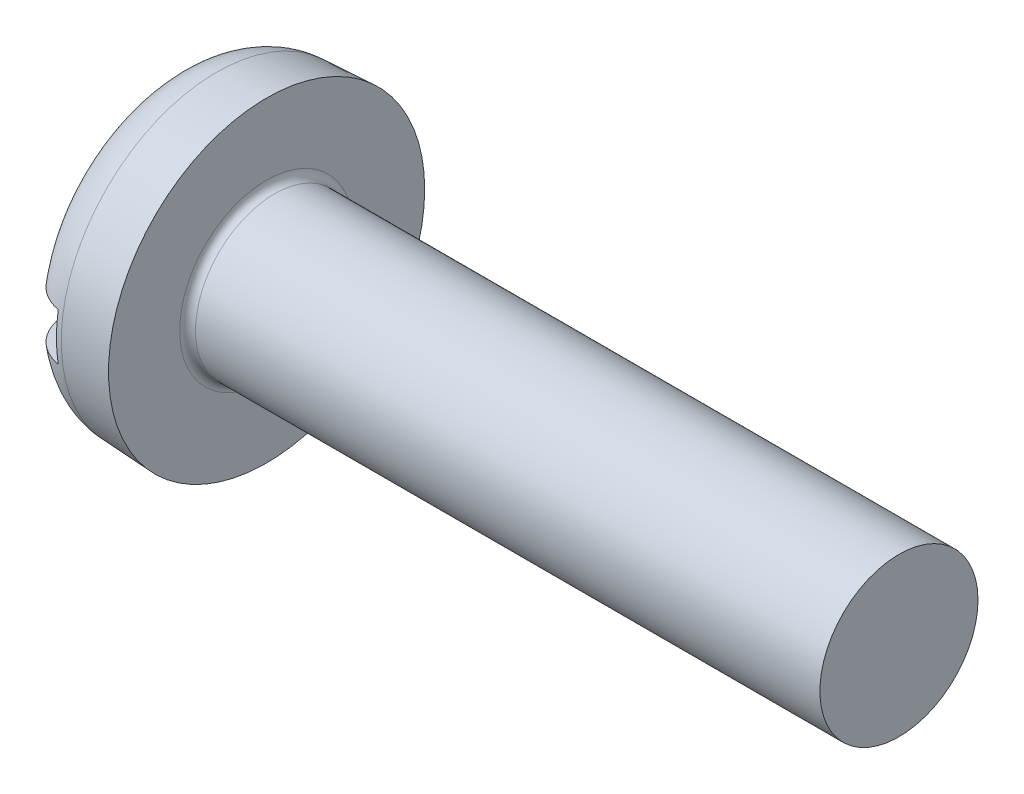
SolidWorks part; units mm, degrees
ref_plane "Front" through (0, 0, 0) normal (0, 0, 1) x (1, 0, 0)
ref_plane "Top" through (0, 0, 0) normal (0, 1, 0) x (1, 0, 0)
ref_plane "Right" through (0, 0, 0) normal (1, 0, 0) x (0, 0, -1)
other "Configuration Table"
ref_plane "Plane1" through (2.4, 0, 0) normal (1, 0, 0) x (0, 0, -1)
sketch "Sketch1" plane through (2.4, 0, 0) normal (1, 0, 0) x (0, 0, -1)
  circle A0 centre (0, 0) radius 4
  dimension "dk" = 8
extrude "BaseHead" add sketch "Sketch1" against normal blind 2.4 draft 3
sketch "Sketch2" plane through (2.4, 0, 0) normal (1, 0, 0) x (0, 0, -1)
  line L0 (0, 0) -> (1.4, 0) construction
  circle A0 centre (0, 0) radius 2
extrude "BaseBody" add sketch "Sketch2" along normal blind 16
fillet "HeadFillet2" radius 1.2 1 edges at (0, 0, -3.8742)
sketch "Sketch3" plane through (1.05, -1.05, 0) normal (0, 0, 1) x (0, -1, 0)
  line L1 (-1.65, -0.05) -> (-0.45, -0.05)
  line L2 (-1.65, -0.05) -> (-1.65, -1.05)
  line L3 (-1.65, -1.05) -> (-0.45, -1.05)
  line L4 (-0.45, -0.05) -> (-0.45, -1.05)
  line L5 (-3.7855, -1.05) -> (1.6855, -1.05) construction
extrude "Notch" cut sketch "Sketch3" against normal through all and the other way through all
fillet "HeadFillet1" radius 0.2 1 edges at (2.4, 0, -2)
sketch "Sketch4" plane through (0, 0, 0) normal (0, 0, 1) x (1, 0, 0)
  line L0 (-19.6, 6.621) -> (-19.6, 2)
  line L1 (2.4, 6.621) -> (-19.6, 6.621)
  line L2 (2.4, 6.621) -> (2.4, 1.621)
  line L3 (2.4, 1.621) -> (-21.35, 1.621)
  line L6 (6.4188, 0) -> (-0.5067, 0) construction
  line L8 (18.4, -2) -> (18.4, 2) construction
  line L9 (-19.6, 2) -> (-21.35, 1.621)
  line L11 (2.4, -4) -> (2.4, 4) construction
  line L12 (18.4, 2) -> (2.6, 2) construction
  dimension "dd" = 5
  dimension "b1" = 3.242
  dimension "b" = 38
  dimension "x" = 1.75
sketch "Sketch5" plane through (0, 0, 0) normal (0, 0, 1) x (1, 0, 0)
  line L0 (18.4, 1.6718) -> (18.5895, 2)
  line L1 (18.5895, 2) -> (18.5895, 2.379)
  line L2 (18.5895, 2.379) -> (18.2105, 2.379)
  line L3 (18.2105, 2.379) -> (18.2105, 2)
  line L4 (18.2105, 2) -> (18.4, 1.6718)
  line L5 (0, 0) -> (4.296, 0) construction
  line L6 (18.4, -2) -> (18.4, 2) construction
revolve "Cut-Revolve10" [suppressed] cut sketch "Sketch5" angle 360 about L5
pattern_linear "LPattern10" [suppressed] count 35 spacing 0.4548 along (1, 0, 0)
equation "\"m@Sketch3\" = \"n@Sketch3\" / 2"
equation "\"D1@Plane1\" = \"k@BaseHead\""
equation "\"D1@Sketch5\" = \"d@Sketch2\""
equation "\"D2@Sketch5\" =  ( \"d@Sketch2\" - \"D2@ThreadCosmetic1\" )  / 2"
equation "\"D3@LPattern10\" = \"D2@Sketch5\" * 1.2"
equation "\"D1@LPattern10\" = \"D1@ThreadCosmetic1\" / \"D3@LPattern10\" "
